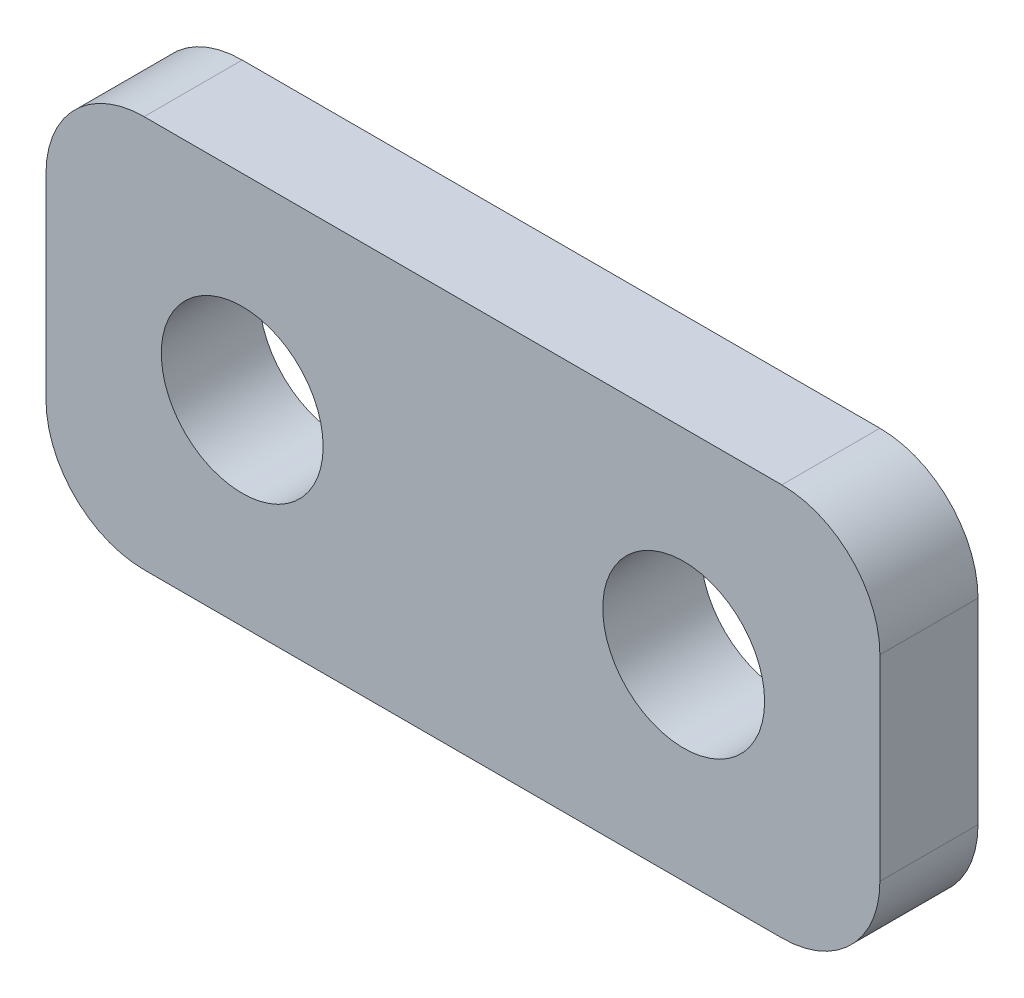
SolidWorks part; units mm, degrees
ref_plane "前视基准面" through (0, 0, 0) normal (0, 0, 1) x (1, 0, 0)
ref_plane "上视基准面" through (0, 0, 0) normal (0, 1, 0) x (1, 0, 0)
ref_plane "右视基准面" through (0, 0, 0) normal (1, 0, 0) x (0, 0, -1)
other "Configuration Table"
sketch "草图1" plane through (0, 0, 0) normal (0, 0, 1) x (1, 0, 0)
  line L1 (-8.5, 4) -> (8.5, 4)
  line L2 (-8.5, 4) -> (-8.5, -4)
  line L3 (-8.5, -4) -> (8.5, -4)
  line L4 (8.5, 4) -> (8.5, -4)
  line L5 (-8.5, 4) -> (8.5, -4) construction
  line L6 (-8.5, -4) -> (8.5, 4) construction
  point P0 (0, 0)
  dimension "D1" = 17
  dimension "D2" = 8
extrude "凸台-拉伸1" add sketch "草图1" along normal blind 2
hole_wizard "M4 螺纹孔1" positions "草图4" profile "草图5" tap size "M4" standard "GB"
sketch "草图4" plane through (0, 0, 2) normal (0, 0, 1) x (1, 0, 0)
  line L0 (-8.5, 4) -> (-8.5, -4) construction
  line L1 (8.5, -4) -> (8.5, 4) construction
  line L2 (8.5, 4) -> (-8.5, 4) construction
  point P0 (-4.5, 0)
  point P2 (4.5, 0)
  dimension "D1" = 4
  dimension "D2" = 4
  dimension "D3" = 4
  dimension "D4" = 4
sketch "草图5" plane through (-4.5, 0, 2) normal (1, 0, 0) x (0, -1, 0)
  line L0 (0, 0) -> (0, 2)
  line L1 (0, 2) -> (1.65, 2)
  line L2 (1.65, 2) -> (1.65, 0)
  line L5 (1.65, 0) -> (0, 0)
  line L11 (0, -6.35) -> (0, 107.95) construction
  dimension "通孔螺纹孔钻头直径" = 3.3
  dimension "通孔螺纹孔钻头深度" = 2
fillet "圆角1" radius 2 4 edges at (8.5, -4, 1) (-8.5, -4, 1) (8.5, 4, 1) (-8.5, 4, 1)
